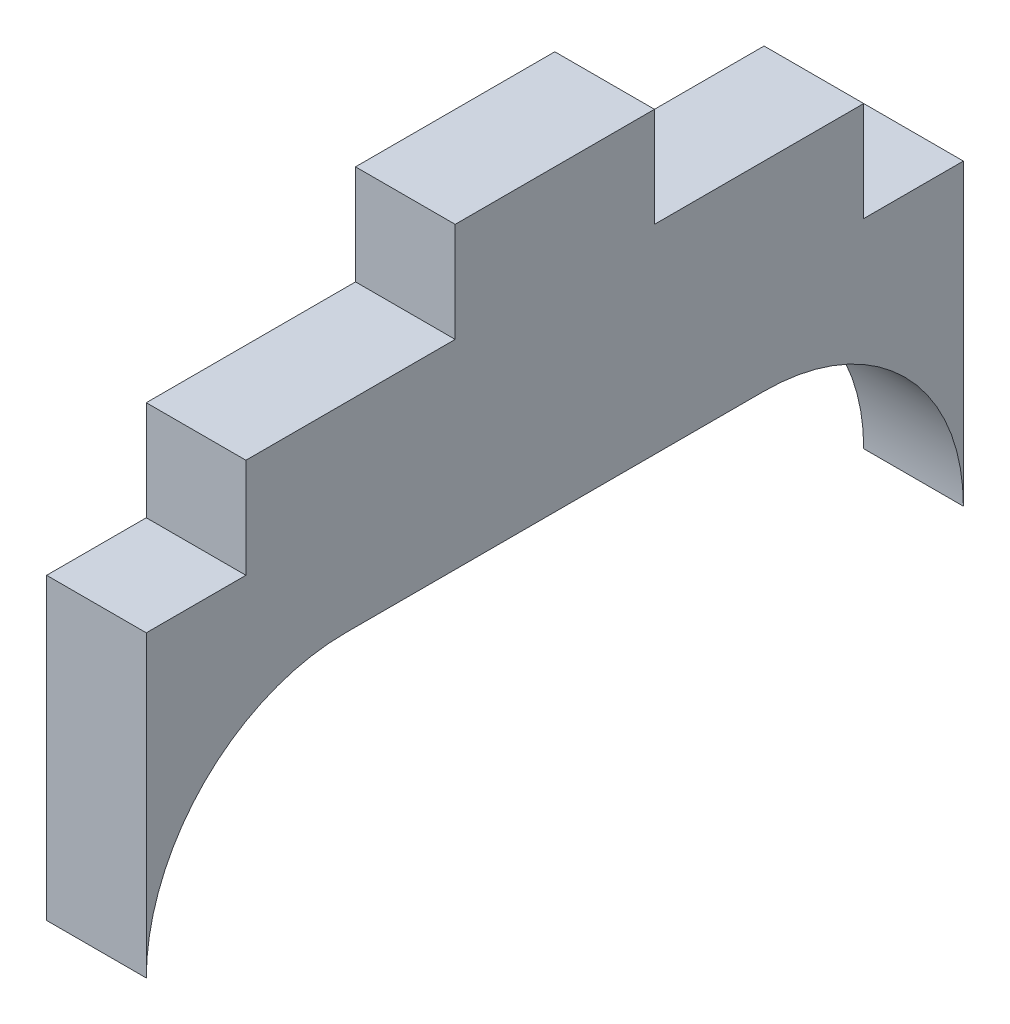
SolidWorks part; units mm, degrees
ref_plane "Plan de face" through (0, 0, 0) normal (0, 0, 1) x (1, 0, 0)
ref_plane "Plan de dessus" through (0, 0, 0) normal (0, 1, 0) x (1, 0, 0)
ref_plane "Plan de droite" through (0, 0, 0) normal (1, 0, 0) x (0, 0, -1)
sketch "Esquisse1" plane through (0, 0, 0) normal (1, 0, 0) x (0, 0, -1)
  line L0 (0, 0) -> (0, 25)
  line L1 (0, 25) -> (41, 25)
  line L2 (41, 25) -> (41, 0)
  line L3 (10, 10) -> (31, 10)
  arc A0 (0, 0) -> (10, 10) centre (10, 0) cw
  arc A1 (31, 10) -> (41, 0) centre (31, 0) cw
  point P9 (20.5, 10)
  point P10 (20.5, 25)
  point P11 (0, 22.6748)
  point P12 (43.1663, 25.0504)
  point P13 (36.7836, 10)
  dimension "D1" = 10
  dimension "D2" = 21
  dimension "D3" = 15
extrude "Boss.-Extru.1" add sketch "Esquisse1" along normal blind 5
sketch "Esquisse2" plane through (5, 0, 0) normal (1, 0, 0) x (0, 0, -1)
  line L0 (41, 25) -> (0, 25) construction
  line L1 (0, 25) -> (15.5, 25)
  line L2 (0, 25) -> (0, 20)
  line L3 (0, 20) -> (15.5, 20)
  line L4 (15.5, 25) -> (15.5, 20)
  line L5 (25.5, 25) -> (41, 25)
  line L6 (25.5, 25) -> (25.5, 20)
  line L7 (25.5, 20) -> (41, 20)
  line L8 (41, 25) -> (41, 20)
  line L9 (41, 0) -> (41, 25) construction
  dimension "D1" = 10
  dimension "D2" = 5
extrude "Enlèv. mat.-Extru.1" cut sketch "Esquisse2" against normal up to next
sketch "Esquisse3" plane through (5, 0, 0) normal (1, 0, 0) x (0, 0, -1)
  line L0 (15.5, 20) -> (15.5, 25) construction
  line L1 (41, 20) -> (36, 20)
  line L2 (41, 20) -> (41, 15)
  line L3 (41, 15) -> (36, 15)
  line L4 (36, 20) -> (36, 15)
  line L5 (0, 20) -> (5, 20)
  line L6 (0, 20) -> (0, 15)
  line L7 (0, 15) -> (5, 15)
  line L8 (5, 20) -> (5, 15)
  point P12 (5, 14.1457)
  dimension "D1" = 5
extrude "Enlèv. mat.-Extru.2" cut sketch "Esquisse3" against normal up to next
